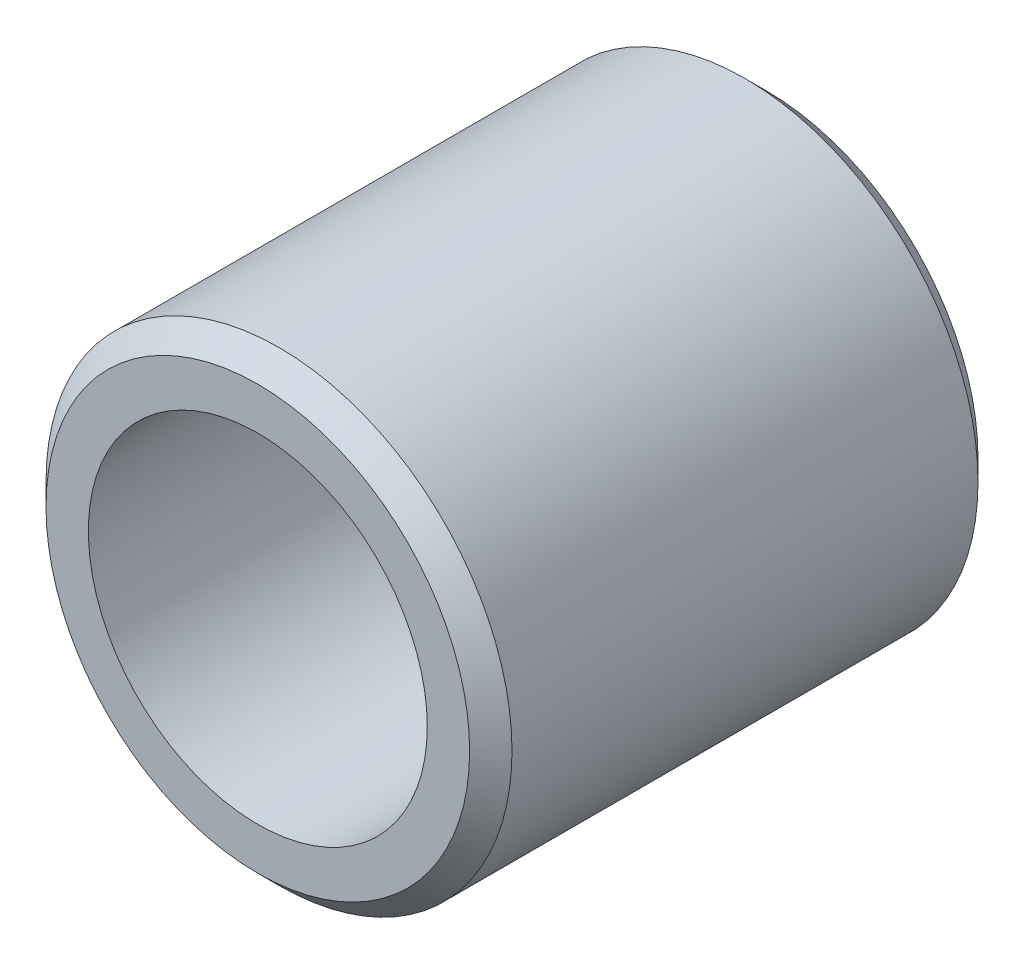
SolidWorks part; units mm, degrees
ref_plane "face" through (0, 0, 0) normal (0, 0, 1) x (1, 0, 0)
ref_plane "dessus" through (0, 0, 0) normal (0, 1, 0) x (1, 0, 0)
ref_plane "droite" through (0, 0, 0) normal (1, 0, 0) x (0, 0, -1)
sketch "Esquisse1" plane through (0, 0, 0) normal (0, 0, 1) x (1, 0, 0)
  circle A0 centre (0, 0) radius 2
  circle A1 centre (0, 0) radius 2.75
  dimension "D1" = 4
  dimension "D2" = 5.5
extrude "Base-Extrusion" add sketch "Esquisse1" along normal blind 6
chamfer "Chanfrein1" distance 0.25 angle 45
